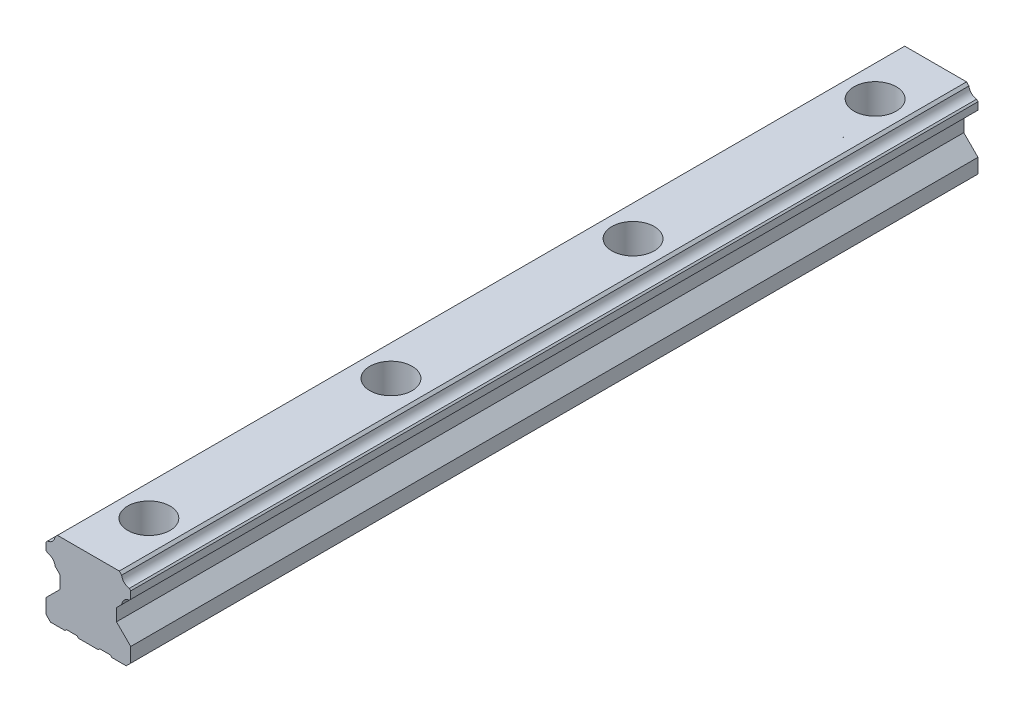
SolidWorks part; units mm, degrees
ref_plane "Front Plane" through (0, 0, 0) normal (0, 0, 1) x (1, 0, 0)
ref_plane "Top Plane" through (0, 0, 0) normal (0, 1, 0) x (1, 0, 0)
ref_plane "Right Plane" through (0, 0, 0) normal (1, 0, 0) x (0, 0, -1)
sketch "Sketch1" plane through (0, 0, 0) normal (0, 0, 1) x (1, 0, 0)
  line L0 (-11.0003, 25.2147) -> (-10.215, 26)
  line L1 (-14, 22.215) -> (-13.5245, 22.6905)
  line L2 (-14, 22.215) -> (-14, 19.7791)
  line L3 (-13.5309, 19.31) -> (-14, 19.7791)
  line L4 (-10.9996, 16.7787) -> (-9.3003, 15.0794)
  line L5 (-9.3003, 15.0794) -> (-9.3003, 10.9996)
  line L6 (-9.3003, 10.9996) -> (-14, 6.3)
  line L7 (-14, 6.3) -> (-14, 1.5)
  line L8 (-14, 1.5) -> (-12.5, 0)
  line L9 (-12.5, 0) -> (-7.75, 0)
  line L10 (-7.25, 0.5) -> (-7.75, 0)
  line L11 (-7.25, 0.5) -> (-3.75, 0.5)
  line L12 (-3.25, 0) -> (-3.75, 0.5)
  line L13 (-3.25, 0) -> (3.25, 0)
  line L14 (3.75, 0.5) -> (3.25, 0)
  line L15 (3.75, 0.5) -> (7.25, 0.5)
  line L16 (7.75, 0) -> (7.25, 0.5)
  line L17 (7.75, 0) -> (12.5, 0)
  line L18 (12.5, 0) -> (14, 1.5)
  line L19 (14, 1.5) -> (14, 6.3)
  line L20 (14, 6.3) -> (9.3003, 10.9996)
  line L21 (9.3003, 10.9996) -> (9.3003, 15.0794)
  line L22 (9.3003, 15.0794) -> (10.9996, 16.7787)
  line L23 (14, 19.7791) -> (13.5309, 19.31)
  line L24 (14, 19.7791) -> (14, 22.215)
  line L25 (13.5245, 22.6905) -> (14, 22.215)
  line L26 (10.215, 26) -> (11.0003, 25.2147)
  line L27 (-10.215, 26) -> (10.215, 26)
  arc A0 (-13.5245, 22.6905) -> (-11.0003, 25.2147) centre (-13.8696, 25.5598) ccw
  arc A1 (-10.9996, 16.7787) -> (-13.5309, 19.31) centre (-13.8696, 16.4399) ccw
  arc A2 (13.5309, 19.31) -> (10.9996, 16.7787) centre (13.8696, 16.4399) ccw
  arc A3 (11.0003, 25.2147) -> (13.5245, 22.6905) centre (13.8696, 25.5598) ccw
extrude "Boss-Extrude1" add sketch "Sketch1" along normal mid plane 280
hole_wizard "CBORE for M4 Hex Socket Head Cap Screw1" positions "Sketch2" profile "Sketch3" counterbore size "M4" standard "DIN"
sketch "Sketch2" plane through (0, 26, 0) normal (0, 1, 0) x (1, 0, 0)
  line L0 (10.215, -140) -> (-10.215, -140) construction
  point P0 (0, -120)
  dimension "D1" = 20
sketch "Sketch3" plane through (0, 26, 120) normal (1, 0, 0) x (0, 0, 1)
  line L0 (0, 0) -> (0, 26)
  line L1 (0, 26) -> (4.5, 26)
  line L3 (4.5, 26) -> (4.5, 12)
  line L4 (4.5, 12) -> (7, 12)
  line L5 (7, 12) -> (7, 0)
  line L7 (7, 0) -> (0, 0)
  line L11 (0, -6.35) -> (0, 107.95) construction
  dimension "Thru Hole Dia." = 9
  dimension "Thru Hole Depth" = 26
  dimension "C'Bore Dia." = 14
  dimension "C'Bore Depth" = 12
pattern_linear "LPattern1" count 4 spacing 80 along (0, 0, -1) of "CBORE for M4 Hex Socket Head Cap Screw1"
